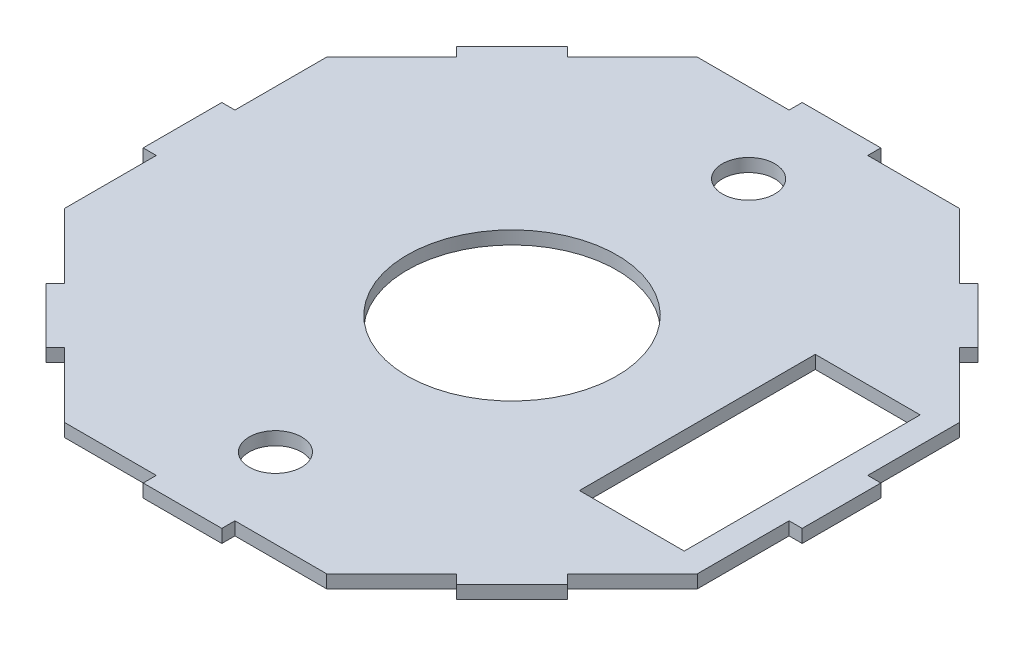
SolidWorks part; units mm, degrees
ref_plane "Alzado" through (0, 0, 0) normal (0, 0, 1) x (1, 0, 0)
ref_plane "Planta" through (0, 0, 0) normal (0, 1, 0) x (1, 0, 0)
ref_plane "Vista lateral" through (0, 0, 0) normal (1, 0, 0) x (0, 0, -1)
sketch "Croquis1" plane through (0, 0, 0) normal (0, 1, 0) x (1, 0, 0)
  line L0 (-30.909, -85.6617) -> (-30.909, -50.6617)
  line L1 (-30.909, 14.3383) -> (-6.1602, 39.087)
  line L2 (39.8017, 85.049) -> (74.8017, 85.049)
  line L3 (139.8017, 85.049) -> (164.5504, 60.3002)
  line L4 (210.5124, 14.3383) -> (210.5124, -20.6617)
  line L5 (210.5124, -85.6617) -> (185.7636, -110.4105)
  line L6 (139.8017, -156.3724) -> (104.8017, -156.3724)
  line L7 (39.8017, -156.3724) -> (15.053, -131.6237)
  line L16 (-35.909, -50.6617) -> (-35.909, -20.6617)
  line L21 (-9.6958, 42.6225) -> (11.5174, 63.8358)
  line L22 (74.8017, 90.049) -> (104.8017, 90.049)
  line L23 (168.086, 63.8358) -> (189.2992, 42.6225)
  line L24 (189.2992, -113.946) -> (168.086, -135.1592)
  line L25 (104.8017, -161.3724) -> (74.8017, -161.3724)
  line L26 (11.5174, -135.1592) -> (-9.6958, -113.946)
  line L27 (215.5124, -20.6617) -> (215.5124, -50.6617)
  line L28 (15.053, 60.3002) -> (39.8017, 85.049)
  line L29 (-30.909, -85.6617) -> (-23.8379, -85.6617)
  line L30 (-35.909, 16.4093) -> (37.7306, 90.049) construction
  line L31 (37.7306, 90.049) -> (141.8728, 90.049) construction
  line L32 (-30.909, -20.6617) -> (-30.909, 14.3383)
  line L33 (164.5504, -131.6237) -> (139.8017, -156.3724)
  line L34 (-30.909, 14.3383) -> (39.8017, 85.049) construction
  line L35 (139.8017, -156.3724) -> (139.292, -155.9055)
  line L36 (-35.909, -85.6617) -> (-35.909, 16.4093) construction
  line L37 (104.8017, 85.049) -> (139.8017, 85.049)
  line L38 (189.2992, -113.946) -> (185.7636, -110.4105)
  line L39 (-9.6958, 42.6225) -> (-6.1602, 39.087)
  line L40 (210.5124, -50.6617) -> (210.5124, -85.6617)
  line L41 (168.086, 63.8358) -> (164.5504, 60.3002)
  line L42 (-35.909, -50.6617) -> (-30.909, -50.6617)
  line L43 (189.2992, 42.6225) -> (185.7636, 39.087)
  line L44 (-35.909, -20.6617) -> (-30.909, -20.6617)
  line L45 (-30.909, -85.6617) -> (-30.909, 14.3383) construction
  line L46 (185.7636, 39.087) -> (210.5124, 14.3383)
  line L47 (39.8017, 85.049) -> (139.8017, 85.049) construction
  line L48 (141.8728, 90.049) -> (214.0479, 17.8738) construction
  line L49 (-30.909, -50.6617) -> (210.5124, -50.6617) construction
  line L50 (-6.1602, -110.4105) -> (-30.909, -85.6617)
  line L51 (15.053, 60.3002) -> (11.5174, 63.8358)
  line L52 (139.8017, 85.049) -> (210.5124, 14.3383) construction
  line L53 (-23.8379, -85.6617) -> (-30.909, -85.6617)
  line L54 (215.5124, 14.3383) -> (215.5124, -85.6617) construction
  line L55 (210.5124, 14.3383) -> (210.5124, -85.6617) construction
  line L56 (214.0479, -89.1973) -> (141.8728, -161.3724) construction
  line L57 (210.5124, -85.6617) -> (139.8017, -156.3724) construction
  line L58 (37.7306, -161.3724) -> (-34.4445, -89.1973) construction
  line L59 (74.8017, -156.3724) -> (39.8017, -156.3724)
  line L60 (-6.1602, -110.4105) -> (-9.6958, -113.946)
  line L61 (-30.909, -85.6617) -> (210.5124, -85.6617) construction
  line L62 (15.053, -131.6237) -> (11.5174, -135.1592)
  line L63 (164.5504, -131.6237) -> (168.086, -135.1592)
  line L64 (39.8017, -156.3724) -> (-30.909, -85.6617) construction
  line L65 (141.8728, -161.3724) -> (37.7306, -161.3724) construction
  line L67 (210.5124, -50.6617) -> (215.5124, -50.6617)
  line L68 (139.8017, -156.3724) -> (39.8017, -156.3724) construction
  line L69 (210.5124, -20.6617) -> (215.5124, -20.6617)
  line L73 (74.8017, -161.3724) -> (74.8017, -156.3724)
  line L74 (104.8017, 90.049) -> (104.8017, 85.049)
  line L77 (74.8017, 85.049) -> (74.8017, 90.049)
  line L79 (104.8017, -156.3724) -> (104.8017, -161.3724)
  circle A0 centre (89.8017, 54.5992) radius 10
  circle A1 centre (89.8017, -35.6617) radius 40
  circle A2 centre (89.8017, -125.9227) radius 10
  point P37 (210.5124, -20.6617)
  point P43 (185.7636, -110.4105)
  dimension "D5" = 80
  dimension "D1" = 135
  dimension "D2" = 135
  dimension "D3" = 135
  dimension "D4" = 135
  dimension "D6" = 135
  dimension "D8" = 100
  dimension "D10" = 100
  dimension "D11" = 100
  dimension "D12" = 5
  dimension "D22" = 35
extrude "Saliente-Extruir1" add sketch "Croquis1" along normal blind 5
sketch "Croquis3" plane through (0, 0, 0) normal (0, -1, 0) x (1, 0, 0)
  line L0 (210.5124, 50.6617) -> (210.5124, 85.6617) construction
  line L1 (200.5124, 80.6617) -> (160.5124, 80.6617)
  line L2 (200.5124, 80.6617) -> (200.5124, -9.3383)
  line L3 (200.5124, -9.3383) -> (160.5124, -9.3383)
  line L4 (160.5124, 80.6617) -> (160.5124, -9.3383)
  dimension "D1" = 10
  dimension "D2" = 90
  dimension "D3" = 40
  dimension "D4" = 5
extrude "Cortar-Extruir2" cut sketch "Croquis3" against normal blind 5
